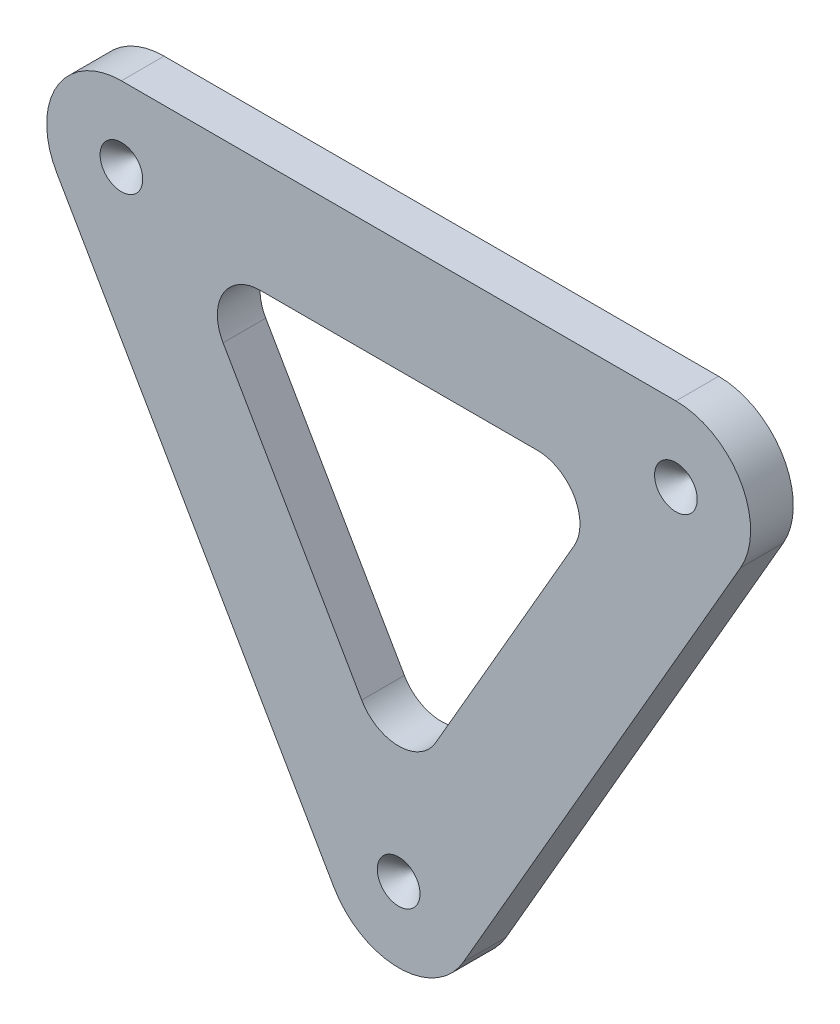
SolidWorks part; units mm, degrees
ref_plane "Ebene vorne" through (0, 0, 0) normal (0, 0, 1) x (1, 0, 0)
ref_plane "Ebene oben" through (0, 0, 0) normal (0, 1, 0) x (1, 0, 0)
ref_plane "Ebene rechts" through (0, 0, 0) normal (1, 0, 0) x (0, 0, -1)
sketch "Skizze1" plane through (0, 0, 0) normal (0, 0, 1) x (1, 0, 0)
  line L1 (3.0311, -16.75) -> (16.0215, 5.75)
  line L2 (12.9904, 11) -> (-12.9904, 11)
  line L3 (-16.0215, 5.75) -> (-3.0311, -16.75)
  line L4 (9.9593, 5.75) -> (-9.9593, 5.75)
  line L5 (-9.9593, 5.75) -> (0, -11.5)
  line L6 (0, -11.5) -> (9.9593, 5.75)
  circle A0 centre (-12.9904, 7.5) radius 3.5 construction
  circle A1 centre (12.9904, 7.5) radius 3.5 construction
  circle A2 centre (0, -15) radius 3.5 construction
  arc A3 (-12.9904, 11) -> (-16.0215, 5.75) centre (-12.9904, 7.5) ccw
  arc A4 (16.0215, 5.75) -> (12.9904, 11) centre (12.9904, 7.5) ccw
  arc A5 (-3.0311, -16.75) -> (3.0311, -16.75) centre (0, -15) ccw
  circle A6 centre (0, 0) radius 11 construction
  circle A7 centre (0, 0) radius 5.75 construction
extrude "Aufsatz-Linear austragen1" add sketch "Skizze1" along normal blind 2
fillet "Verrundung1" radius 2 3 edges at (-9.9593, 5.75, 1) (0, -11.5, 1) (9.9593, 5.75, 1)
sketch "Skizze2" plane through (0, 0, 2) normal (0, 0, 1) x (1, 0, 0)
  circle A0 centre (12.9904, 7.5) radius 1
  circle A1 centre (0, -15) radius 1
  circle A2 centre (-12.9904, 7.5) radius 1
  dimension "D1" = 2
extrude "Schnitt-Linear austragen1" cut sketch "Skizze2" against normal blind 1 draft 45
